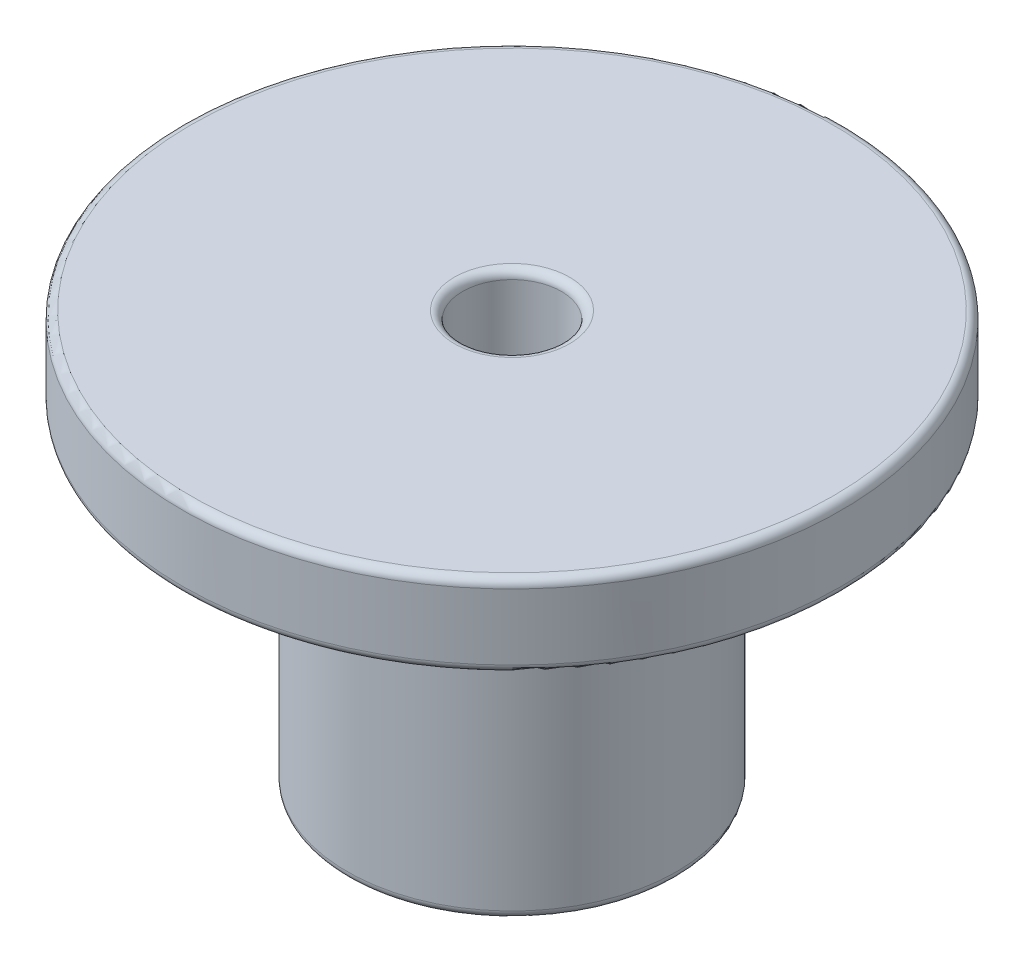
SolidWorks part; units mm, degrees
ref_plane "Спереди" through (0, 0, 0) normal (0, 0, 1) x (1, 0, 0)
ref_plane "Сверху" through (0, 0, 0) normal (0, 1, 0) x (1, 0, 0)
ref_plane "Справа" through (0, 0, 0) normal (1, 0, 0) x (0, 0, -1)
sketch "Эскиз1" plane through (0, 0, 0) normal (0, 0, 1) x (1, 0, 0)
  line L0 (0, 0) -> (0, -12.5) construction
  line L1 (-1.5, 0) -> (-1.5, -12.5)
  line L2 (-1.5, -12.5) -> (-5, -12.5)
  line L3 (-5, -12.5) -> (-5, -2.5)
  line L4 (-5, -2.5) -> (-10, -2.5)
  line L5 (-10, -2.5) -> (-10, 0)
  line L6 (-10, 0) -> (-1.5, 0)
  dimension "D1" = 3
  dimension "D2" = 10
  dimension "D3" = 2.5
  dimension "D4" = 20
  dimension "D5" = 10
revolve "Повернуть1" add sketch "Эскиз1" angle 360 about L0
fillet "Скругление1" radius 0.25 6 edges at (-1.5, -12.5, 0) (-1.5, 0, 0) (-5, -2.5, 0) (-5, -12.5, 0) (-10, 0, 0) (-10, -2.5, 0)
